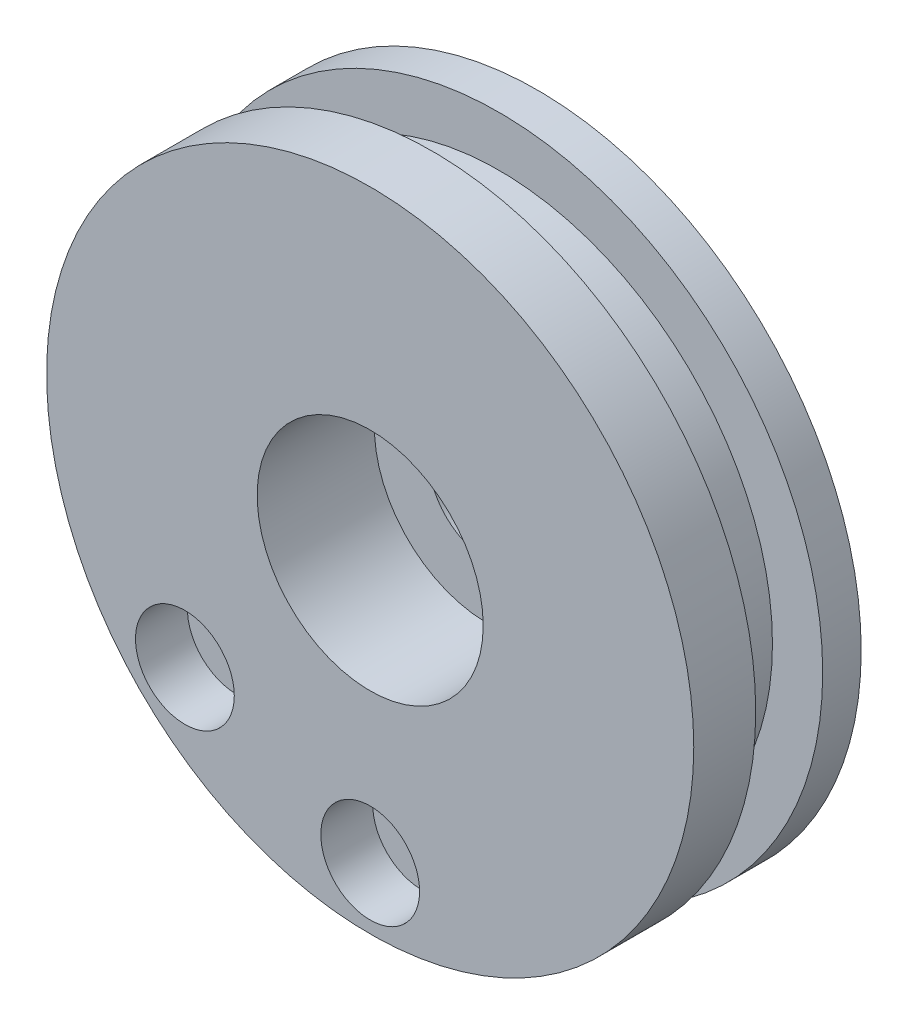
SolidWorks part; units mm, degrees
ref_plane "Front Plane" through (0, 0, 0) normal (0, 0, 1) x (1, 0, 0)
ref_plane "Top Plane" through (0, 0, 0) normal (0, 1, 0) x (1, 0, 0)
ref_plane "Right Plane" through (0, 0, 0) normal (1, 0, 0) x (0, 0, -1)
sketch "Sketch1" plane through (0, 0, 0) normal (0, 0, 1) x (1, 0, 0)
  circle A0 centre (0, 0) radius 9.8171
  dimension "D1" = 19.6342
extrude "Extrude1" add sketch "Sketch1" along normal blind 5.08
sketch "Sketch2" plane through (0, 0, 5.08) normal (0, 0, 1) x (1, 0, 0)
  circle A0 centre (0, 0) radius 1.778
  dimension "D1" = 3.556
extrude "Cut-Extrude1" cut sketch "Sketch2" against normal through all
sketch "Sketch3" plane through (0, 0, 5.08) normal (0, 0, 1) x (1, 0, 0)
  circle A0 centre (0, 0) radius 3.429
  dimension "D1" = 6.858
extrude "Cut-Extrude2" cut sketch "Sketch3" against normal blind 3.556
sketch "Sketch4" plane through (0, 0, 5.08) normal (0, 0, 1) x (1, 0, 0)
  line L0 (0, 0) -> (0, -10.1808) construction
  line L1 (0, 0) -> (-7.5442, -7.5442) construction
  circle A0 centre (0, 0) radius 7.9502 construction
  circle A1 centre (0, -7.9502) radius 1.4986
  circle A2 centre (-5.6216, -5.6216) radius 1.4986
  dimension "D2" = 15.9004
  dimension "D3" = 2.9972
  dimension "D4" = 2.9972
  dimension "D1" = 45
extrude "Cut-Extrude3" cut sketch "Sketch4" against normal blind 1.5748
ref_plane "Plane1" through (0, 0, 3.2004) normal (0, 0, 1) x (1, 0, 0)
sketch "Sketch5" plane through (0, 0, 3.2004) normal (0, 0, 1) x (1, 0, 0)
  circle A0 centre (0, 0) radius 8.2931
  dimension "D1" = 16.5862
extrude "Cut-Extrude4" cut sketch "Sketch5" against normal blind 2.032 flip side to cut
sketch "Sketch6" plane through (0, 0, 0) normal (0, 0, -1) x (-1, 0, 0)
  circle A0 centre (0, 0) radius 3.1877
  dimension "D1" = 6.3754
extrude "Cut-Extrude5" cut sketch "Sketch6" against normal blind 0.635
